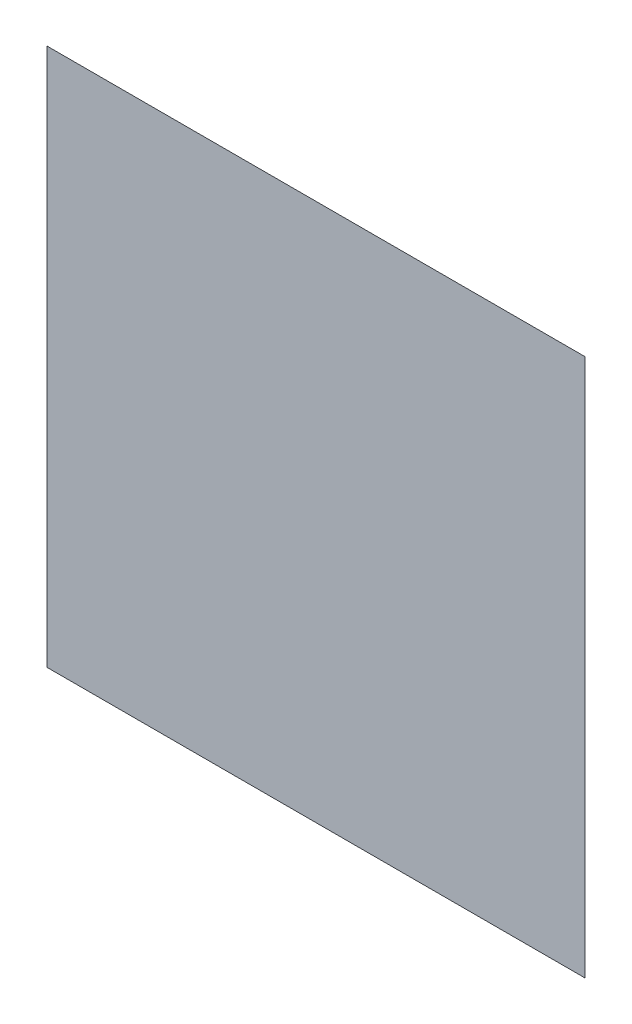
SolidWorks part; units mm, degrees
ref_plane "Ebene vorne" through (0, 0, 0) normal (0, 0, 1) x (1, 0, 0)
ref_plane "Ebene oben" through (0, 0, 0) normal (0, 1, 0) x (1, 0, 0)
ref_plane "Ebene rechts" through (0, 0, 0) normal (1, 0, 0) x (0, 0, -1)
sketch "Skizze1" plane through (0, 0, 0) normal (0, 0, 1) x (1, 0, 0)
  line L0 (-25, -25) -> (-25, 68.8034) construction
  line L1 (-25, -25) -> (220.2842, -25) construction
  line L2 (-25, 25) -> (25, -25) construction
  line L3 (-25, -25) -> (25, -25)
  line L4 (-25, -25) -> (-25, 25)
  line L5 (-25, 25) -> (25, 25)
  line L6 (25, -25) -> (25, 25)
  line L7 (25, -25) -> (25.4959, -25.4727) construction
  dimension "D1" = 50
surface "Oberfläche-Ebene1" sketch "Skizze1"
equation "\"LÄNGE\"=0"
equation "\"BREITE\"=0"
equation "\"HÖHE\"=0"
equation "\"DURCHMESSER\"=0"
equation "\"Stückzahl\"= 1"
